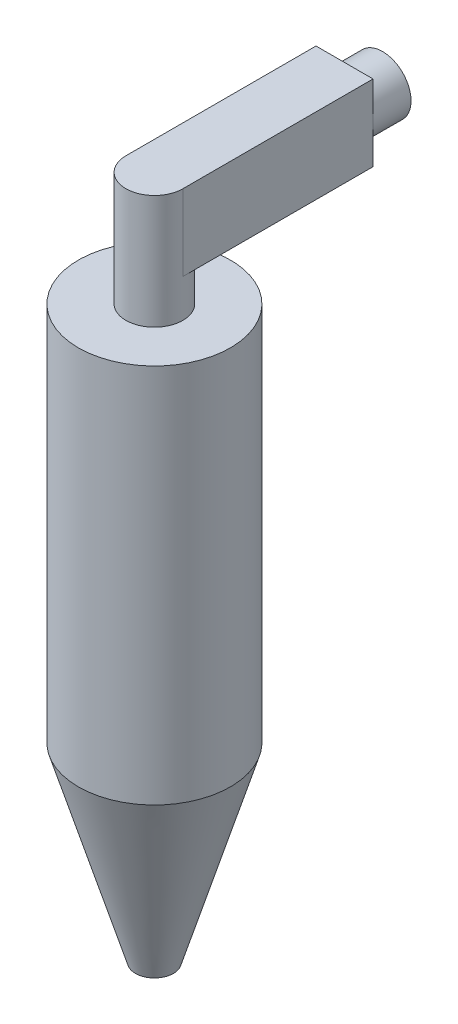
SolidWorks part; units mm, degrees
ref_plane "Front Plane" through (0, 0, 0) normal (0, 0, 1) x (1, 0, 0)
ref_plane "Top Plane" through (0, 0, 0) normal (0, 1, 0) x (1, 0, 0)
ref_plane "Right Plane" through (0, 0, 0) normal (1, 0, 0) x (0, 0, -1)
sketch "Sketch_Nuzzle Vent" plane through (0, 0, 0) normal (0, 1, 0) x (1, 0, 0)
  line L0 (0, 0) -> (0, 5) construction
  circle A0 centre (0, 0) radius 5
  point P11 (0, 5)
  dimension "D2" = 10
ref_plane "Plane_Nuzzle Neck" through (0, 50, 0) normal (0, 1, 0) x (1, 0, 0)
sketch "Sketch_Nuzzle Path" plane through (0, 50, 0) normal (0, 1, 0) x (1, 0, 0)
  line L0 (0, 0) -> (0, 20) construction
  circle A0 centre (0, 0) radius 20
  point P8 (0, 20)
  dimension "D1" = 40
loft "Loft_Nuzzle" add profiles "Sketch_Nuzzle Path", "Sketch_Nuzzle Vent"
sketch "Sketch_Nuzzle Neck" plane through (0, 50, 0) normal (0, 1, 0) x (1, 0, 0)
  circle A1 centre (0, 0) radius 20
  circle A2 centre (0, 0) radius 20
  dimension "D1" = 0
extrude "Nuzzle Neck" add sketch "Sketch_Nuzzle Neck" along normal blind 100
ref_plane "Plane_Linkage" through (0, 150, 0) normal (0, 1, 0) x (1, 0, 0)
sketch "Sketch_Linkage" plane through (0, 150, 0) normal (0, 1, 0) x (1, 0, 0)
  circle A0 centre (0, 0) radius 7.5
  dimension "D1" = 15
extrude "Linkage" add sketch "Sketch_Linkage" along normal blind 30
sketch "Sketch_Linkage Neck" plane through (0, 0, 0) normal (0, 0, 1) x (1, 0, 0)
  line L0 (7.5, 180) -> (-7.5, 180) construction
  line L1 (-7.5, 180) -> (7.5, 180)
  line L2 (-7.5, 180) -> (-7.5, 160)
  line L3 (-7.5, 160) -> (7.5, 160)
  line L4 (7.5, 180) -> (7.5, 160)
  line L5 (-7.5, 180) -> (-7.5, 150) construction
  line L6 (7.5, 150) -> (7.5, 180) construction
  dimension "D1" = 20
extrude "Linkage Neck" add sketch "Sketch_Linkage Neck" against normal blind 50
ref_plane "Plane_Linkage Pivot" through (0, 0, -50) normal (0, 0, -1) x (-1, 0, 0)
sketch "Sketch_Linkage Pivot" plane through (0, 0, -50) normal (0, 0, -1) x (-1, 0, 0)
  line L0 (-7.5, 170) -> (7.5, 170) construction
  line L1 (-7.5, 160) -> (-7.5, 180) construction
  line L2 (7.5, 180) -> (7.5, 160) construction
  circle A0 centre (0, 170) radius 7.5
  point P8 (0, 0)
extrude "Linkage Pivot" add sketch "Sketch_Linkage Pivot" along normal blind 10
